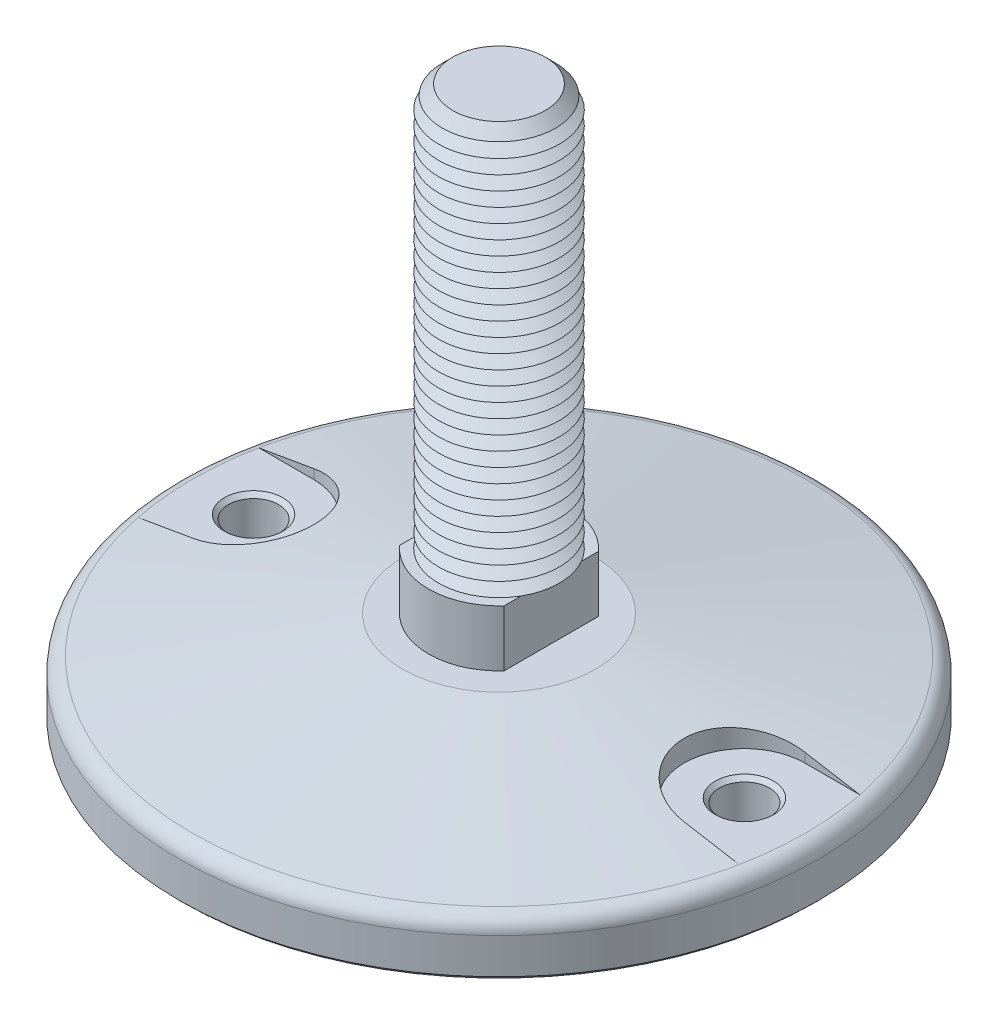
SolidWorks part; units mm, degrees
ref_plane "Front Plane" through (0, 0, 0) normal (0, 0, 1) x (1, 0, 0)
ref_plane "Top Plane" through (0, 0, 0) normal (0, 1, 0) x (1, 0, 0)
ref_plane "Right Plane" through (0, 0, 0) normal (1, 0, 0) x (0, 0, -1)
sketch "Sketch1" plane through (0, 0, 0) normal (1, 0, 0) x (0, 0, -1)
  line L0 (0, 61.3389) -> (0, -58.404) construction
sketch "Sketch2" plane through (0, 0, 0) normal (1, 0, 0) x (0, 0, -1)
  line L0 (0, 0) -> (-24, 0)
  line L1 (-24, 0) -> (-79.5, -9.7861)
  line L2 (-79.5, -9.7861) -> (-79.5, -23)
  line L3 (-79.5, -23) -> (0, -23)
  line L4 (0, 61.3389) -> (0, -58.404) construction
  line L5 (0, -23) -> (0, 0)
  dimension "D1" = 23
  dimension "D2" = 79.5
  dimension "D3" = 24
  dimension "D4" = 10
revolve "Revolve1" add sketch "Sketch2" angle 360 about L0
fillet "Fillet1" radius 4 1 edges at (0, -9.7861, 79.5)
sketch "Sketch3" plane through (0, 0, 0) normal (0, 1, 0) x (1, 0, 0)
  circle A0 centre (0, 0) radius 17.5
  dimension "D1" = 35
extrude "Boss-Extrude1" add sketch "Sketch3" along normal blind 14
sketch "Sketch4" plane through (0, 14, 0) normal (0, 1, 0) x (1, 0, 0)
  line L0 (-13, 11.7154) -> (-13, -11.7154)
  line L2 (13, -11.7154) -> (13, 11.7154)
  arc A0 (-13, 11.7154) -> (-13, -11.7154) centre (0, 0) ccw
  circle A1 centre (0, 0) radius 17.5 construction
  arc A2 (13, -11.7154) -> (13, 11.7154) centre (0, 0) ccw
  dimension "D1" = 26
extrude "Cut-Extrude1" cut sketch "Sketch4" against normal blind 14
sketch "Sketch5" plane through (0, 14, 0) normal (0, 1, 0) x (1, 0, 0)
  circle A0 centre (0, 0) radius 15
  dimension "D1" = 30
extrude "Boss-Extrude2" add sketch "Sketch5" along normal blind 100
chamfer "Chamfer1" distance 3.5 angle 45 1 edges at (0, 114, 15)
sketch "Sketch6" plane through (0, 0, 0) normal (1, 0, 0) x (0, 0, -1)
  line L0 (-15, 14) -> (-11.9689, 15.75)
  line L1 (-11.9689, 15.75) -> (-15, 17.5)
  line L2 (-15, 110.5) -> (-15, 14) construction
  line L3 (-15, 17.5) -> (-15, 14)
  dimension "D1" = 3.5
revolve "Cut-Revolve1" cut sketch "Sketch6" angle 360 about L0
pattern_linear "LPattern1" count 28 spacing 3.5 along (0, 1, 0) of "Cut-Revolve1"
sketch "Sketch8" plane through (0, 0, 0) normal (0, 1, 0) x (1, 0, 0)
  line L0 (-61, 15) -> (-74.7035, 15)
  line L1 (-61, -15) -> (-74.7035, -15)
  arc A1 (-74.7035, 15) -> (-74.7035, -15) centre (0, 0) ccw
  circle A2 centre (0, 0) radius 76.1946 construction
  arc A3 (-61, -15) -> (-61, 15) centre (-61, 0) ccw
  point P3 (-61, 0)
  point P11 (0, 0)
  dimension "D1" = 61
  dimension "D2" = 30
extrude "Cut-Extrude4" cut sketch "Sketch8" against normal blind 9.2
sketch "Sketch10" plane through (0, -9.2, 0) normal (0, 1, 0) x (1, 0, 0)
  circle A0 centre (-61, 0) radius 6.25
  dimension "D1" = 12.5
extrude "Cut-Extrude5" cut sketch "Sketch10" against normal up to surface (13.8 mm away)
chamfer "Chamfer2" distance 1 angle 45 2 edges at (-61, -23, -6.25) (-61, -9.2, 6.25)
mirror "Mirror1" about plane through (0, 0, 0) normal (1, 0, 0) of "Chamfer2", "Cut-Extrude5", "Cut-Extrude4"
chamfer "Chamfer3" distance 1 angle 45 1 edges at (0, -23, 79.5)
